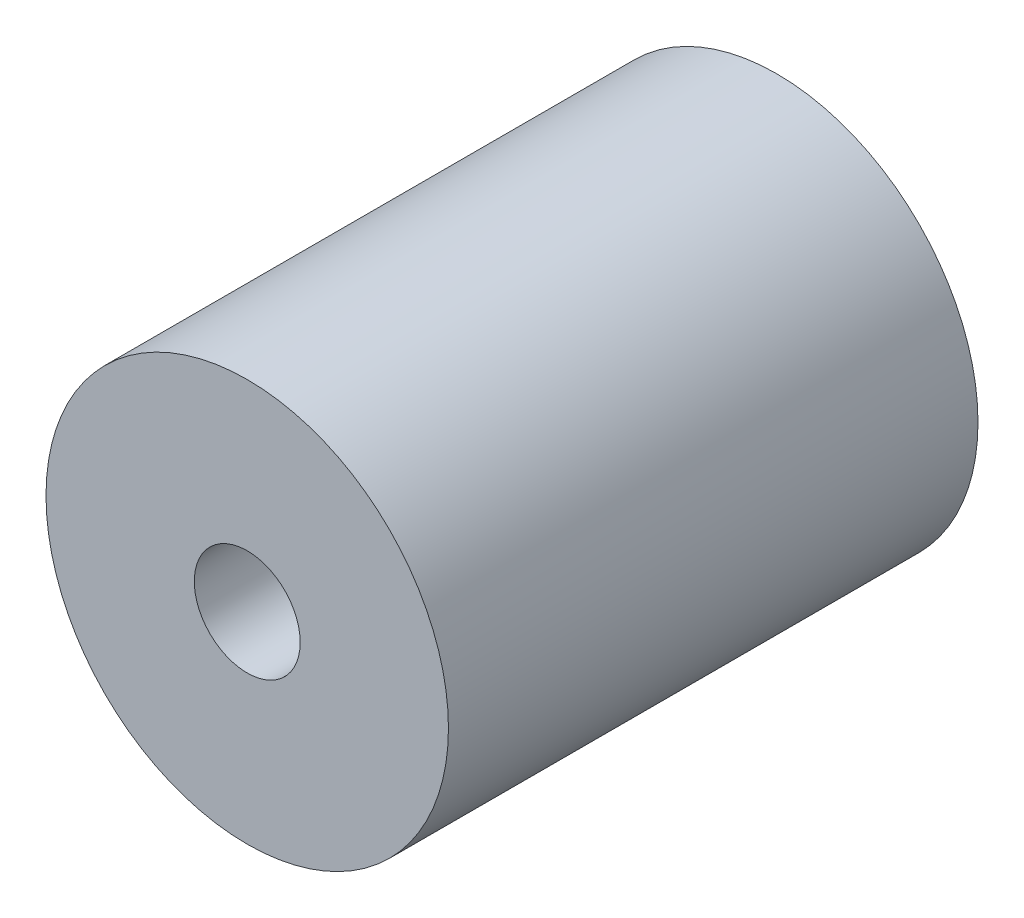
SolidWorks part; units mm, degrees
ref_plane "Alzado" through (0, 0, 0) normal (0, 0, 1) x (1, 0, 0)
ref_plane "Planta" through (0, 0, 0) normal (0, 1, 0) x (1, 0, 0)
ref_plane "Vista lateral" through (0, 0, 0) normal (1, 0, 0) x (0, 0, -1)
sketch "Croquis1" plane through (0, 0, 0) normal (0, 0, 1) x (1, 0, 0)
  circle A0 centre (0, 0) radius 2
  circle A1 centre (0, 0) radius 9.5
  dimension "D1" = 4
  dimension "D2" = 19
extrude "Saliente-Extruir1" add sketch "Croquis1" along normal blind 25
sketch "Croquis2" plane through (0, 0, 25) normal (0, 0, 1) x (1, 0, 0)
  circle A0 centre (0, 0) radius 2.5
  dimension "D1" = 5
extrude "Cortar-Extruir1" cut sketch "Croquis2" against normal blind 15
